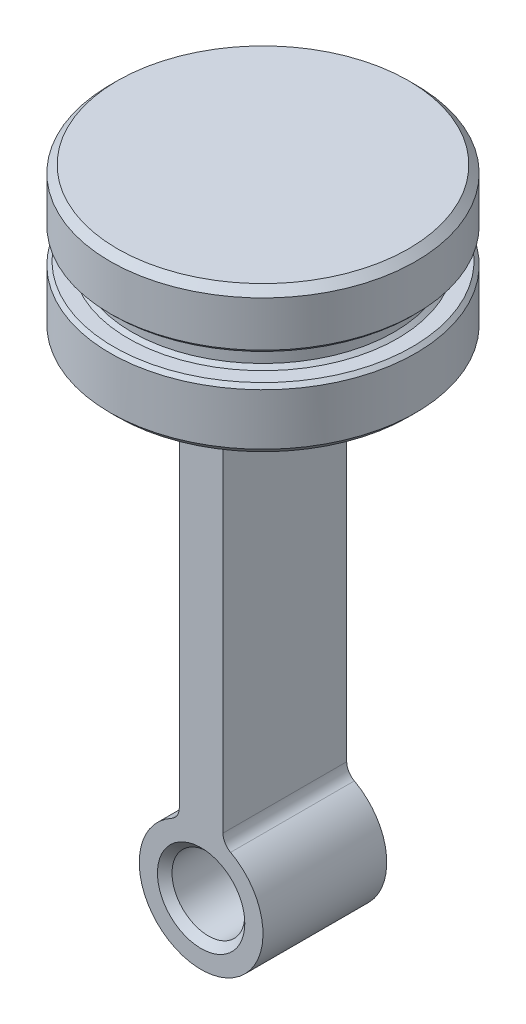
SolidWorks part; units mm, degrees
ref_plane "Face" through (0, 0, 0) normal (0, 0, 1) x (1, 0, 0)
ref_plane "Dessus" through (0, 0, 0) normal (0, 1, 0) x (1, 0, 0)
ref_plane "Droite" through (0, 0, 0) normal (1, 0, 0) x (0, 0, -1)
sketch "Esquisse1" plane through (0, 0, 0) normal (0, 0, 1) x (1, 0, 0)
  line L0 (-1.5, 31.5) -> (-1.5, 3.9765)
  line L1 (1.5, 31.5) -> (1.5, 3.9765)
  line L2 (1.5, 31.5) -> (-1.5, 31.5)
  arc A0 (-1.5, 3.9765) -> (1.5, 3.9765) centre (0, 0) ccw
  dimension "D1" = 8.5
  dimension "D3" = 1.5
  dimension "D4" = 3
  dimension "D6" = 31.5
extrude "Base-Extrusion" add sketch "Esquisse1" against normal blind 8.5
sketch "Esquisse2" plane through (0, 0, 0) normal (0, 0, 1) x (1, 0, 0)
  circle A1 centre (0, 0) radius 2.5
  dimension "D2" = 5
extrude "Enlèv. mat.-Extru.1" cut sketch "Esquisse2" against normal through all
fillet "Congé1" radius 1 2 edges at (1.5, 3.9765, -4.25) (-1.5, 3.9765, -4.25)
chamfer "Chanfrein1" distance 0.5 angle 45 2 edges at (2.5, 0, -8.5) (2.5, 0, 0)
ref_plane "Plan1" through (0, 0, -4.25) normal (0, 0, 1) x (1, 0, 0)
ref_plane "Plan2" through (0, 38, 0) normal (0, 1, 0) x (-1, 0, 0)
sketch "Esquisse3" plane through (0, 31.5, 0) normal (0, 1, 0) x (1, 0, 0)
  line L0 (1.5, 0) -> (-1.5, 0) construction
  circle A0 centre (0, 4.25) radius 10.5
  dimension "D2" = 21
  dimension "D1" = 4.25
extrude "Boss.-Extru.1" add sketch "Esquisse3" along normal blind 10
fillet "Congé2" radius 1 4 edges at (0, 31.5, -8.5) (-1.5, 31.5, -4.25) (0, 31.5, 0) (1.5, 31.5, -4.25)
chamfer "Chanfrein2" distance 0.5 angle 45 2 edges at (0, 31.5, 6.25) (0, 41.5, 6.25)
ref_axis "Axe1" through (0, 41, -4.25) along (0, -1, 0)
sketch "Esquisse5" plane through (0, 0, 0) normal (1, 0, 0) x (0, 0, -1)
  line L0 (-6.25, 37.6405) -> (-4.75, 37.6405)
  line L1 (-6.25, 41) -> (-6.25, 32) construction
  line L2 (-4.75, 37.6405) -> (-4.75, 35.7897)
  line L3 (-4.75, 35.7897) -> (-6.25, 35.7897)
  line L5 (-6.25, 37.6405) -> (-6.25, 35.7897)
  dimension "D1" = 1.5
  dimension "D2" = 1.8508
revolve "Enlèvement de matière-Révolution1" cut sketch "Esquisse5" angle 360 about axis through (0, 41, -4.25) along (0, -1, 0)
chamfer "Chanfrein3" distance 0.25 angle 45 4 edges at (0, 35.7897, 6.25) (0, 35.7897, 4.75) (0, 37.6405, 4.75) (0, 37.6405, 6.25)
